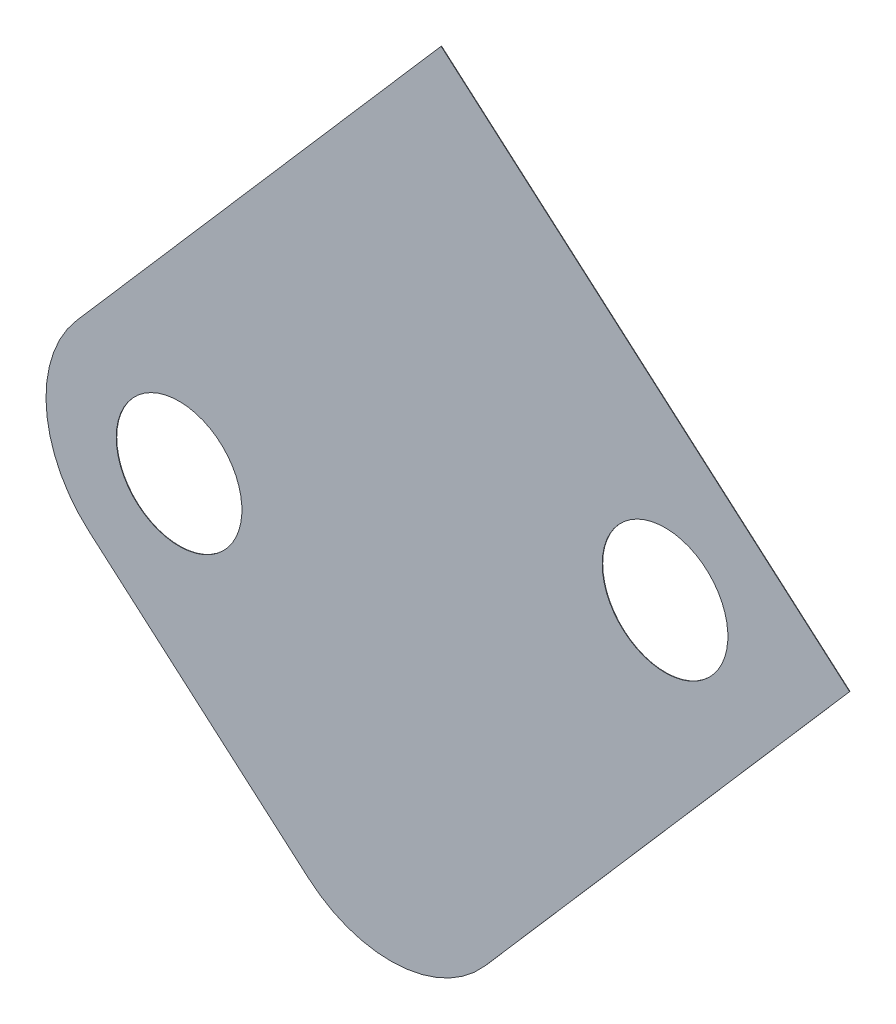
SolidWorks part; units mm, degrees
ref_plane "Front" through (0, 0, 0) normal (0, 0, 1) x (1, 0, 0)
ref_plane "Top" through (0, 0, 0) normal (0, 1, 0) x (1, 0, 0)
ref_plane "Right" through (0, 0, 0) normal (1, 0, 0) x (0, 0, -1)
sketch "Sketch1" plane through (0, 0, 0) normal (0, 0, 1) x (1, 0, 0)
  line L8 (-662.206, -84.9077) -> (-685.4111, -64.7557)
  line L9 (-682.9101, -108.7486) -> (-662.206, -84.9077)
  line L10 (-705.4087, -98.6297) -> (-692.9431, -109.4551)
  line L11 (-685.4111, -64.7557) -> (-706.1152, -88.5966)
  line L12 (-662.206, -84.9077) -> (-685.4111, -64.7557)
  line L13 (-682.9101, -108.7486) -> (-662.206, -84.9077)
  line L14 (-705.4087, -98.6297) -> (-692.9431, -109.4551)
  line L15 (-685.4111, -64.7557) -> (-706.1152, -88.5966)
  arc A4 (-692.9431, -109.4551) -> (-682.9101, -108.7486) centre (-688.2799, -104.0853) ccw
  arc A5 (-706.1152, -88.5966) -> (-705.4087, -98.6297) centre (-700.7454, -93.2599) ccw
  arc A6 (-692.9431, -109.4551) -> (-682.9101, -108.7486) centre (-688.2799, -104.0853) ccw
  arc A7 (-706.1152, -88.5966) -> (-705.4087, -98.6297) centre (-700.7454, -93.2599) ccw
  dimension "D1" = 0.508
extrude "Boss-Extrude1" add sketch "Sketch1" along normal blind 0.0254 separate body
hole_wizard "Hole1" positions "Point_Sketch" profile "Profil_Sketch" hole size "Ø0.15" standard "ISO"
sketch "Point_Sketch" plane through (-669.0327, -75.0446, 0) normal (0, 0, 1) x (-1, 0, 0)
  point P0 (3.6543, 10.6011)
  point P2 (31.2649, 18.1837)
sketch "Profil_Sketch" plane through (-672.6869, -85.6458, 0) normal (1, 0, 0) x (0, 1, 0)
  line L0 (0, 0) -> (0, 0.0254)
  line L1 (0, 0.0254) -> (3.5687, 0.0254)
  line L2 (3.5687, 0.0254) -> (3.5687, 0)
  line L5 (3.5687, 0) -> (0, 0)
  line L11 (0, -6.35) -> (0, 107.95) construction
  dimension "Diameter" = 7.1374
  dimension "Thru Hole Depth" = 0.0254
other "usin_DL090_.25-20x3-SHCS<1>"
